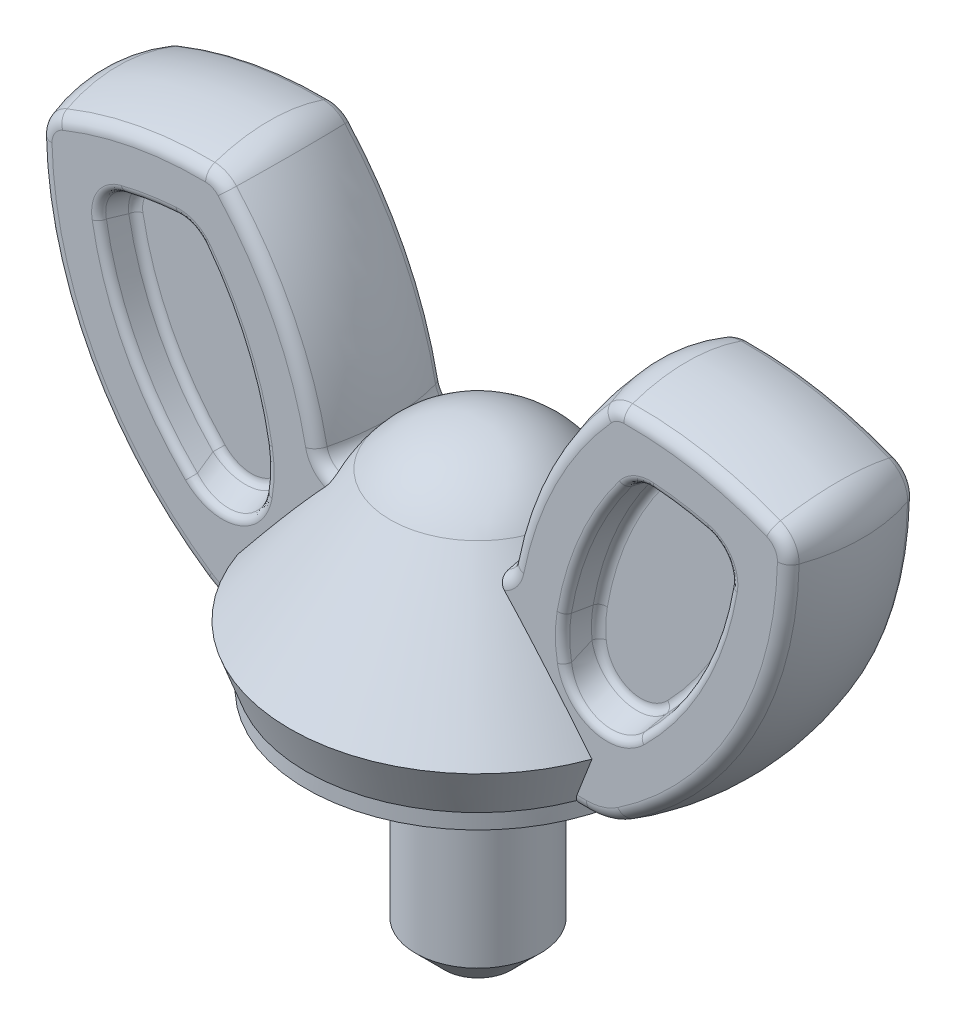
SolidWorks part; units mm, degrees
ref_plane "Front Plane" through (0, 0, 0) normal (0, 0, 1) x (1, 0, 0)
ref_plane "Top Plane" through (0, 0, 0) normal (0, 1, 0) x (1, 0, 0)
ref_plane "Right Plane" through (0, 0, 0) normal (1, 0, 0) x (0, 0, -1)
other "Configuration Table"
sketch "Sketch1" plane through (0, 0, 0) normal (0, 0, 1) x (1, 0, 0)
  line L0 (0, 10.7344) -> (0, 0) construction
  line L5 (4.826, 0) -> (-4.826, 0)
  line L6 (2.413, 5.08) -> (-2.413, 5.08)
  arc A11 (-2.413, 5.08) -> (-5.3975, 10.9034) centre (-13.1787, 3.2391) ccw
  arc A13 (-5.3975, 10.9034) -> (-10.795, 9.8298) centre (-6.0342, 0) ccw
  arc A24 (-10.795, 9.8298) -> (-6.0486, 0.3742) centre (0, 9.3295) ccw
  arc A26 (-4.826, 0) -> (-6.0486, 0.3742) centre (-4.826, 2.1844) cw
  arc A29 (4.826, 0) -> (6.0486, 0.3742) centre (4.826, 2.1844) ccw
  arc A34 (10.795, 9.8298) -> (6.0486, 0.3742) centre (0, 9.3295) cw
  arc A36 (5.3975, 10.9034) -> (10.795, 9.8298) centre (6.0342, 0) cw
  arc A37 (2.413, 5.08) -> (5.3975, 10.9034) centre (13.1787, 3.2391) cw
  point P19 (0, 0)
  point P27 (0, 5.08)
  point P29 (0, 5.08)
  point P44 (0, 5.08)
extrude "Extrude1" add sketch "Sketch1" along normal mid plane 3.556
fillet "Fillet4" radius 1.0922 4 edges at (10.795, 9.8298, 0) (5.3975, 10.9034, 0) (-5.3975, 10.9034, 0) (-10.795, 9.8298, 0)
sketch "Sketch2" plane through (0, 0, 1.778) normal (0, 0, 1) x (1, 0, 0)
  line L0 (0, 0) -> (0, 12.8329) construction
  line L1 (-4.826, 0) -> (4.826, 0) construction
  arc A10 (-4.1864, 4.7767) -> (-5.0416, 1.8652) centre (-7.5893, 4.1949) cw
  arc A11 (4.1864, 4.7767) -> (6.2055, 9.1212) centre (13.1787, 3.2391) cw
  arc A12 (6.2055, 9.1212) -> (8.9805, 8.634) centre (6.0342, 0) cw
  arc A13 (8.9805, 8.634) -> (5.0416, 1.8652) centre (0, 9.3295) cw
  arc A14 (4.1864, 4.7767) -> (5.0416, 1.8652) centre (7.5893, 4.1949) ccw
  arc A15 (-8.9805, 8.634) -> (-5.0416, 1.8652) centre (0, 9.3295) ccw
  arc A16 (-6.2055, 9.1212) -> (-8.9805, 8.634) centre (-6.0342, 0) ccw
  arc A17 (-4.1864, 4.7767) -> (-6.2055, 9.1212) centre (-13.1787, 3.2391) ccw
  arc A18 (-8.9805, 8.634) -> (-5.0416, 1.8652) centre (0, 9.3295) ccw
  arc A19 (-6.2055, 9.1212) -> (-8.9805, 8.634) centre (-6.0342, 0) ccw
  arc A20 (-4.1864, 4.7767) -> (-6.2055, 9.1212) centre (-13.1787, 3.2391) ccw
extrude "Cut-Extrude1" cut sketch "Sketch2" against normal blind 0.889 draft 10
fillet "Fillet1" radius 0.889 4 edges
fillet "Fillet6" radius 1.2446 2 edges
fillet "Fillet5" radius 0.3641 2 edges at (2.413, 5.08, 0) (-2.413, 5.08, 0)
fillet "Fillet3" radius 0.2223 28 edges at (7.4585, 9.011, 1.778) (7.4007, 8.8613, 0.889) (6.4621, 8.9114, 0.889) (8.6146, 8.3041, 0.889) (7.8855, 5.3103, 0.889) (4.2988, 4.3764, 0.889) (6.1282, 8.9579, 1.778) (8.7221, 8.5339, 1.778) (7.9776, 5.1471, 1.778) (4.1377, 4.1292, 1.778) (-4.2988, 4.3764, 0.889) (-7.8855, 5.3103, 0.889) (-8.5332, 8.4279, 0.889) (-7.4007, 8.8613, 0.889) (-6.1942, 8.7899, 0.889) (-4.1377, 4.1292, 1.778) (-7.9776, 5.1471, 1.778) (-8.7866, 8.4358, 1.778) (-7.4585, 9.011, 1.778) (-6.3795, 9.0717, 1.778) (4.9351, 6.7652, 0.889) (4.81, 6.8709, 1.778) (-4.9351, 6.7652, 0.889) (-4.81, 6.8709, 1.778) (4.9742, 2.938, 0.889) (5.0791, 2.5366, 1.778) (-5.2102, 2.8514, 0.889) (-5.0131, 2.5568, 1.778)
mirror "Mirror1" about plane through (0, 0, 0) normal (0, 0, 1) of "Fillet6", "Fillet3", "Fillet1", "Cut-Extrude1"
sketch "Sketch4" plane through (0, 0, 0) normal (1, 0, 0) x (0, 0, -1)
  line L1 (-1.778, 5.334) -> (1.778, 5.334)
  line L2 (-1.778, 4.4704) -> (-1.778, 5.334)
  line L4 (1.778, 0.3742) -> (1.778, 9.0918) construction
  line L6 (-1.778, 9.0918) -> (-1.778, 0.3742) construction
  line L7 (0, 5.715) -> (0, 0.381) construction
  line L9 (1.778, 4.4704) -> (1.778, 5.334)
  line L10 (-1.778, 5.08) -> (1.778, 5.08) construction
  arc A0 (-1.524, 4.826) -> (-1.778, 4.4704) centre (-1.4021, 4.4704) ccw
  arc A1 (1.524, 4.826) -> (-1.524, 4.826) centre (0, 0.381) ccw
  arc A2 (1.524, 4.826) -> (1.778, 4.4704) centre (1.4021, 4.4704) cw
  point P8 (0, 5.08)
sketch3d "3DSketch1"
  line L2 (-2.1102, 5.08, 1.778) -> (2.1102, 5.08, 1.778)
  line L3 (4.826, 0, 1.778) -> (-4.826, 0, 1.778)
  line L4 (-2.1102, 5.08, 1.778) -> (2.1102, 5.08, 1.778)
  line L5 (4.826, 0, 1.778) -> (-4.826, 0, 1.778)
  arc A15 (10.804, 9.0918, 1.778) -> (6.0486, 0.3742, 1.778) centre (0, 9.3295, 1.778) ccw
  arc A16 (10.1207, 10.1287, 1.778) -> (10.804, 9.0918, 1.778) centre (9.712, 9.1158, 1.778) ccw
  arc A17 (5.8682, 10.9207, 1.778) -> (10.1207, 10.1287, 1.778) centre (6.0342, 0, 1.778) ccw
  arc A18 (5.0743, 10.5608, 1.778) -> (5.8682, 10.9207, 1.778) centre (5.8848, 9.8287, 1.778) ccw
  arc A19 (2.4672, 5.3729, 1.778) -> (5.0743, 10.5608, 1.778) centre (13.1787, 3.2391, 1.778) ccw
  arc A20 (2.1102, 5.08, 1.778) -> (2.4672, 5.3729, 1.778) centre (2.1102, 5.4441, 1.778) ccw
  arc A21 (2.1102, 5.08, 1.778) -> (2.4672, 5.3729, 1.778) centre (2.1102, 5.4441, 1.778) ccw
  arc A22 (-5.0743, 10.5608, 1.778) -> (-2.4672, 5.3729, 1.778) centre (-13.1787, 3.2391, 1.778) ccw
  arc A23 (-5.8682, 10.9207, 1.778) -> (-5.0743, 10.5608, 1.778) centre (-5.8848, 9.8287, 1.778) ccw
  arc A24 (-10.1207, 10.1287, 1.778) -> (-5.8682, 10.9207, 1.778) centre (-6.0342, 0, 1.778) ccw
  arc A25 (-10.804, 9.0918, 1.778) -> (-10.1207, 10.1287, 1.778) centre (-9.712, 9.1158, 1.778) ccw
  arc A26 (-6.0486, 0.3742, 1.778) -> (-10.804, 9.0918, 1.778) centre (0, 9.3295, 1.778) ccw
  arc A27 (-4.826, 0, 1.778) -> (-6.0486, 0.3742, 1.778) centre (-4.826, 2.1844, 1.778) ccw
  arc A28 (6.0486, 0.3742, 1.778) -> (4.826, 0, 1.778) centre (4.826, 2.1844, 1.778) ccw
  arc A29 (10.804, 9.0918, 1.778) -> (6.0486, 0.3742, 1.778) centre (0, 9.3295, 1.778) ccw
  arc A30 (10.1207, 10.1287, 1.778) -> (10.804, 9.0918, 1.778) centre (9.712, 9.1158, 1.778) ccw
  arc A31 (5.8682, 10.9207, 1.778) -> (10.1207, 10.1287, 1.778) centre (6.0342, 0, 1.778) ccw
  arc A32 (5.0743, 10.5608, 1.778) -> (5.8682, 10.9207, 1.778) centre (5.8848, 9.8287, 1.778) ccw
  arc A33 (2.4672, 5.3729, 1.778) -> (5.0743, 10.5608, 1.778) centre (13.1787, 3.2391, 1.778) ccw
  arc A34 (-2.4672, 5.3729, 1.778) -> (-2.1102, 5.08, 1.778) centre (-2.1102, 5.4441, 1.778) ccw
  arc A35 (-2.4672, 5.3729, 1.778) -> (-2.1102, 5.08, 1.778) centre (-2.1102, 5.4441, 1.778) ccw
  arc A36 (-5.0743, 10.5608, 1.778) -> (-2.4672, 5.3729, 1.778) centre (-13.1787, 3.2391, 1.778) ccw
  arc A37 (-5.8682, 10.9207, 1.778) -> (-5.0743, 10.5608, 1.778) centre (-5.8848, 9.8287, 1.778) ccw
  arc A38 (-10.1207, 10.1287, 1.778) -> (-5.8682, 10.9207, 1.778) centre (-6.0342, 0, 1.778) ccw
  arc A39 (-10.804, 9.0918, 1.778) -> (-10.1207, 10.1287, 1.778) centre (-9.712, 9.1158, 1.778) ccw
  arc A40 (-6.0486, 0.3742, 1.778) -> (-10.804, 9.0918, 1.778) centre (0, 9.3295, 1.778) ccw
  arc A41 (-4.826, 0, 1.778) -> (-6.0486, 0.3742, 1.778) centre (-4.826, 2.1844, 1.778) ccw
  arc A42 (6.0486, 0.3742, 1.778) -> (4.826, 0, 1.778) centre (4.826, 2.1844, 1.778) ccw
  point P3 (2.1102, 5.4441, 2.1421)
  point P5 (2.1102, 5.4441, 2.1421)
  point P11 (-2.1102, 5.4441, 2.1421)
  point P13 (-2.1102, 5.4441, 2.1421)
  point P43 (0, 9.3295, -9.0286)
  point P46 (9.712, 9.1158, 0.6858)
  point P48 (6.0342, 0, -9.144)
  point P50 (5.8848, 9.8287, 0.6858)
  point P52 (13.1787, 3.2391, -9.144)
  point P58 (-13.1787, 3.2391, -9.144)
  point P60 (-5.8848, 9.8287, 0.6858)
  point P62 (-6.0342, 0, -9.144)
  point P64 (-9.712, 9.1158, 0.6858)
  point P66 (0, 9.3295, -9.0286)
  point P68 (-4.826, 2.1844, -0.4064)
  point P70 (4.826, 2.1844, -0.4064)
  point P71 (0, 9.3295, -9.0286)
  point P72 (9.712, 9.1158, 0.6858)
  point P73 (6.0342, 0, -9.144)
  point P74 (5.8848, 9.8287, 0.6858)
  point P75 (13.1787, 3.2391, -9.144)
  point P78 (-13.1787, 3.2391, -9.144)
  point P79 (-5.8848, 9.8287, 0.6858)
  point P80 (-6.0342, 0, -9.144)
  point P81 (-9.712, 9.1158, 0.6858)
  point P82 (0, 9.3295, -9.0286)
  point P83 (-4.826, 2.1844, -0.4064)
  point P84 (4.826, 2.1844, -0.4064)
  dimension "D1" = 0
sweep "Cut-Sweep2" cut profiles "Sketch4" path "3DSketch1"
sketch "Sketch3" plane through (0, 0, 0) normal (0, 0, 1) x (1, 0, 0)
  line L0 (0, 6.5903) -> (0, -11.3525) construction
  line L1 (1.7526, 0) -> (4.826, 0)
  line L2 (5.2882, 1.6933) -> (2.4672, 5.3729)
  line L4 (1.7526, 0) -> (1.7526, -6.35)
  line L5 (1.7526, -6.35) -> (0, -6.35)
  line L6 (4.826, 0) -> (4.826, 0.4233)
  line L7 (0, 6.5903) -> (0, -6.35)
  line L8 (0, 6.5903) -> (-2.4754, 6.5903) construction
  line L9 (4.826, 0.4233) -> (5.2882, 1.6933)
  arc A1 (2.4672, 5.3729) -> (0, 6.5903) centre (0, 3.4814) ccw
revolve "Revolve1" add sketch "Sketch3" angle 360 about L0
sketch "Sketch6" plane through (0, 0, 0) normal (0, 0, 1) x (1, 0, 0)
  line L0 (0, 4.5862) -> (0, -4.5862) construction
  line L1 (0.9398, -6.35) -> (0, -5.7853)
  line L2 (0, -5.7853) -> (0, -6.604)
  line L3 (0, -6.604) -> (1.778, -6.604)
  line L4 (1.778, -6.604) -> (1.778, -5.5118)
  line L5 (1.778, -5.5118) -> (0.9398, -6.35)
  line L6 (-1.7526, -6.35) -> (1.7526, -6.35) construction
  line L7 (1.7526, -6.35) -> (1.7526, 0) construction
  dimension "D1" = 45
  dimension "D2" = 59
  dimension "D3" = 0.254
  dimension "O" = 1.8796
  dimension "D5" = 0.0254
revolve "Cut-Revolve11" cut sketch "Sketch6" angle 360 about L0
sketch "Sketch5" plane through (0, 0, 0) normal (0, 0, 1) x (1, 0, 0)
  line L0 (1.7526, -0.0254) -> (1.2802, -0.2982)
  line L1 (1.2802, -0.2982) -> (1.7526, -0.5709)
  line L2 (1.7526, -0.5709) -> (1.7526, -0.0254)
  line L3 (0, 0) -> (0, -7.7715) construction
  line L6 (1.2802, -0.2982) -> (1.2802, -1.0906) construction
revolve "Cut-Revolve10" [suppressed] cut sketch "Sketch5" angle 360 about L3
pattern_linear "LPattern10" [suppressed] count 8 spacing 0.7925 along (0, -1, 0)
equation "\"D5@Sketch1\" = \"E@Sketch1\" / 2"
equation "\"D1@Sketch1\" = \"A@Sketch1\" / 4"
equation "\"D3@Sketch1\" = \"B@Sketch1\" * 9 /  10"
equation "\"D4@Sketch1\" = \"B@Sketch1\""
equation "\"D2@Sketch1\" = \"D4@Sketch1\" / 5"
equation "\"D1@Cut-Extrude1\" = \"C@Extrude1\" / 4"
equation "\"D1@Fillet1\" = \"D1@Cut-Extrude1\""
equation "\"D1@Fillet3\" = \"D1@Cut-Extrude1\" / 4"
equation "\"D2@Sketch3\" = \"G@Sketch1\" / 4"
equation "\"D3@Sketch3\" = \"E@Sketch1\""
equation "\"D1@Sketch4\" = \"C@Extrude1\" / 14"
equation "\"D1@Sketch5\" = \"d1@Sketch3\""
equation "\"D2@Sketch5\" = \"THD_MINOR@Cosmetic Thread1\""
equation "\"D3@LPattern10\" = \"pitch@Sketch5\""
equation "\"D1@LPattern10\" = \"L@Sketch3\" / \"D3@LPattern10\""
equation "\"D1@Cosmetic Thread1\" = \"L@Sketch3\""
equation "\"D2@Sketch4\" = \"D1@Sketch4\""
equation "\"D4@Sketch3\" = \"D2@Sketch3\" / 3"
equation "\"D1@Fillet4\" = \"D2@Sketch1\" /2"
equation "\"D1@Sketch2\" = \"D1@Sketch1\" / 3"
equation "\"D1@Fillet5\" = \"D1@Fillet4\" / 3"
equation "\"D1@Fillet6\" = \"D1@Fillet1\" * 1.4"
